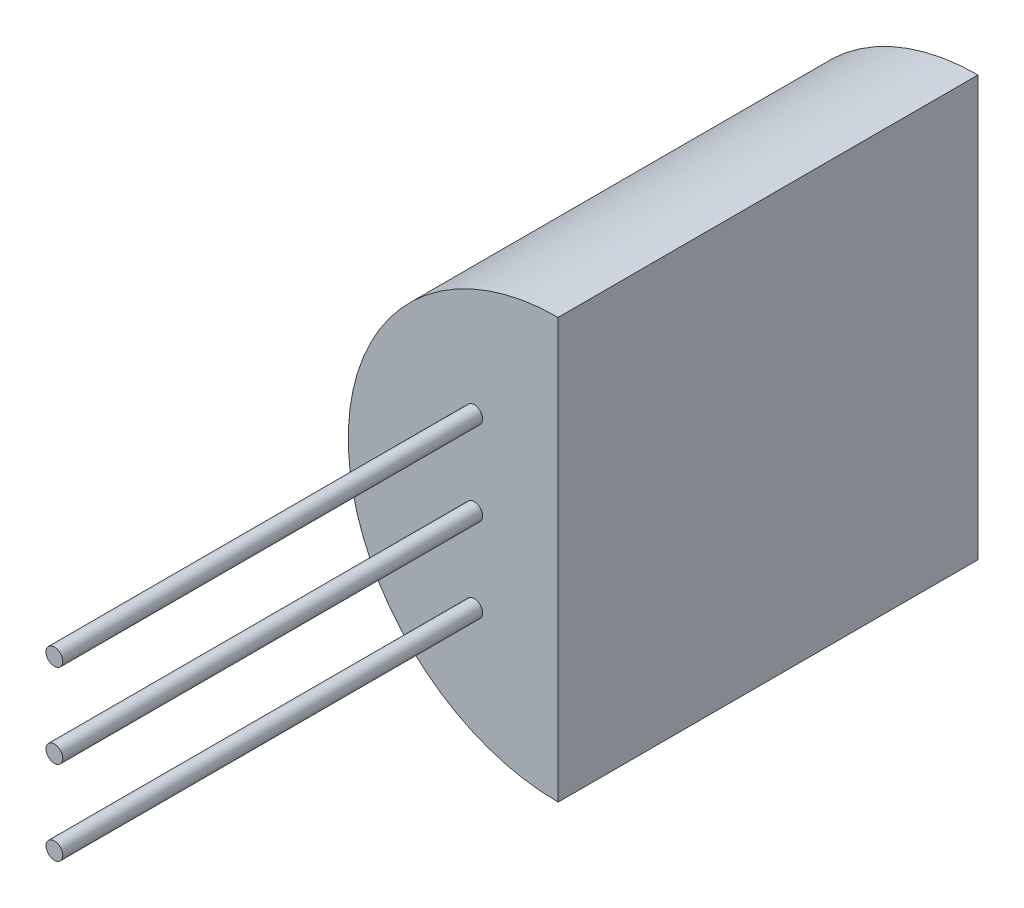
SolidWorks part; units mm, degrees
ref_plane "Plan de face" through (0, 0, 0) normal (0, 0, 1) x (1, 0, 0)
ref_plane "Plan de dessus" through (0, 0, 0) normal (0, 1, 0) x (1, 0, 0)
ref_plane "Plan de droite" through (0, 0, 0) normal (1, 0, 0) x (0, 0, -1)
sketch "Esquisse1" plane through (0, 0, 0) normal (0, 0, 1) x (1, 0, 0)
  circle A0 centre (-2.0239, 1.449) radius 2.5
  dimension "D1" = 5
extrude "Boss.-Extru.1" add sketch "Esquisse1" along normal blind 5
sketch "Esquisse2" plane through (0, 0, 5) normal (0, 0, 1) x (1, 0, 0)
  line L0 (-2.0239, 3.949) -> (-2.0239, -1.051)
  circle A0 centre (-2.0239, 1.449) radius 2.5
extrude "Enlèv. mat.-Extru.1" cut sketch "Esquisse2" against normal blind 5 contours A0 L0
sketch "Esquisse3" plane through (0, 0, 5) normal (0, 0, 1) x (1, 0, 0)
  line L0 (-2.0239, 3.949) -> (-2.0239, -1.051) construction
  circle A0 centre (-3.0239, 2.449) radius 0.1
  circle A1 centre (-3.0239, 1.449) radius 0.1
  circle A2 centre (-3.0239, 0.449) radius 0.1
  arc A3 (-2.0239, 3.949) -> (-2.0239, -1.051) centre (-2.0239, 1.449) ccw construction
  dimension "D1" = 0.2
  dimension "D2" = 0.2
  dimension "D3" = 0.2
  dimension "D4" = 1
  dimension "D5" = 1
  dimension "D6" = 1
  dimension "D7" = 1
  dimension "D8" = 1
  dimension "D9" = 1
extrude "Boss.-Extru.2" add sketch "Esquisse3" along normal blind 5
